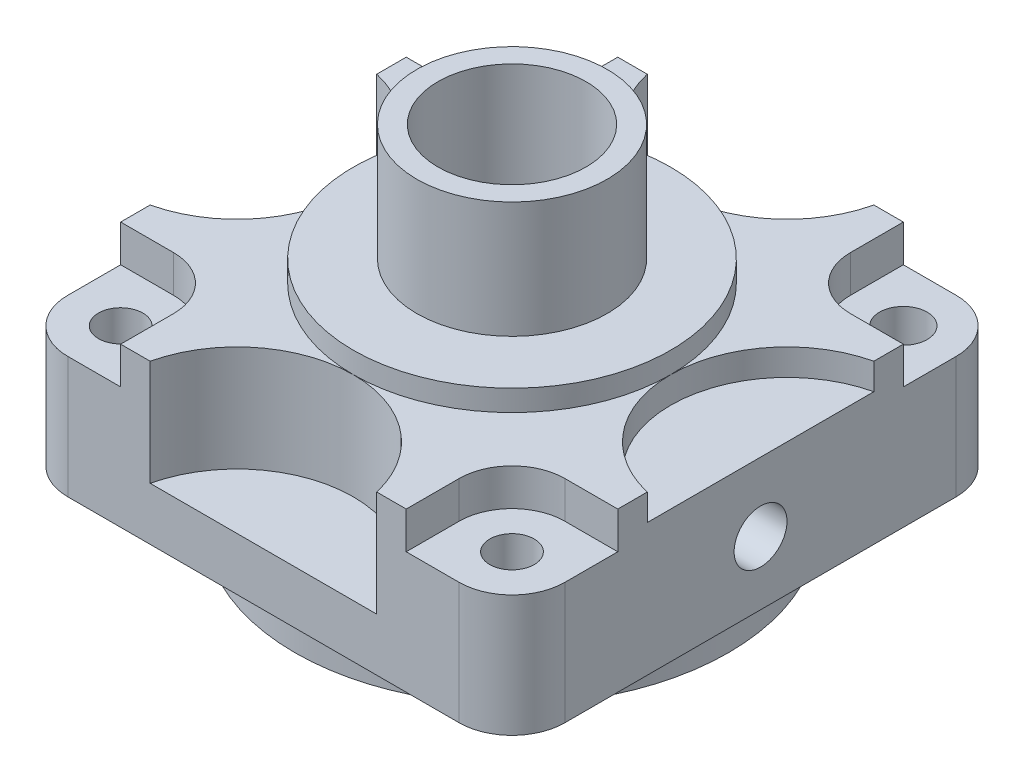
SolidWorks part; units mm, degrees
ref_plane "Plan de face" through (0, 0, 0) normal (0, 0, 1) x (1, 0, 0)
ref_plane "Plan de dessus" through (0, 0, 0) normal (0, 1, 0) x (1, 0, 0)
ref_plane "Plan de droite" through (0, 0, 0) normal (1, 0, 0) x (0, 0, -1)
sketch "Esquisse1" plane through (0, 0, 0) normal (0, 0, 1) x (1, 0, 0)
  line L1 (-23.5, 15) -> (23.5, 15)
  line L2 (-23.5, 15) -> (-23.5, 0)
  line L3 (-23.5, 0) -> (23.5, 0)
  line L4 (23.5, 15) -> (23.5, 0)
  dimension "D1" = 47
  dimension "D2" = 23.5
  dimension "D3" = 15
extrude "Extrusion1" add sketch "Esquisse1" along normal blind 47
sketch "Esquisse2" plane through (0, 0, 0) normal (0, -1, 0) x (1, 0, 0)
  circle A0 centre (0, 23.5285) radius 20.5
  dimension "D1" = 41
extrude "Extrusion2" add sketch "Esquisse2" along normal blind 5
sketch "Esquisse3" plane through (0, -5, 0) normal (0, -1, 0) x (1, 0, 0)
  circle A0 centre (0, 23.5285) radius 9.75
  dimension "D1" = 19.5
extrude "Extrusion3" add sketch "Esquisse3" along normal blind 3.5
sketch "Esquisse4" plane through (0, 15, 0) normal (0, 1, 0) x (-1, 0, 0)
  line L0 (-23.5, 47) -> (-23.5, 0) construction
  circle A0 centre (0, 23.5) radius 15
  dimension "D1" = 30
  dimension "D2" = 23.5
  dimension "D3" = 23.5
extrude "Extrusion4" add sketch "Esquisse4" along normal blind 2
sketch "Esquisse5" plane through (0, 17, 0) normal (0, 1, 0) x (-1, 0, 0)
  circle A0 centre (0, 23.5) radius 9
  dimension "D1" = 18
extrude "Extrusion5" add sketch "Esquisse5" along normal blind 11
sketch "Esquisse6" plane through (0, 28, 0) normal (0, 1, 0) x (-1, 0, 0)
  circle A0 centre (0, 23.5) radius 7
  dimension "D1" = 14
extrude "Enlèv. mat.-Extru.1" cut sketch "Esquisse6" against normal blind 13
sketch "Esquisse7" plane through (0, 15, 0) normal (0, 1, 0) x (-1, 0, 0)
  circle A0 centre (0, 23.5) radius 5.75
  dimension "D1" = 11.5
extrude "Enlèv. mat.-Extru.2" cut sketch "Esquisse7" against normal through all
sketch "Esquisse8" plane through (0, -8.5, 0) normal (0, -1, 0) x (1, 0, 0)
  circle A0 centre (0, 23.5285) radius 8.25
  dimension "D1" = 16.5
extrude "Enlèv. mat.-Extru.3" cut sketch "Esquisse8" against normal blind 17
sketch "Esquisse9" plane through (0, 15, 0) normal (0, 1, 0) x (-1, 0, 0)
  line L0 (0, -14.2918) -> (0, 143.899) construction
  line L1 (0, 23.5) -> (-77.8064, 23.5) construction
  line L2 (-23.5, 0) -> (23.5, 0) construction
  line L3 (23.5, 47) -> (23.5, 0) construction
  line L4 (0, 23.5) -> (84.5721, 23.5) construction
  line L5 (-23.5, 47) -> (23.5, 47) construction
  line L6 (-10.7121, 0) -> (10.7121, 0)
  line L13 (-10.7121, 47) -> (10.7121, 47)
  line L14 (23.5, 12.7879) -> (23.5, 34.2121)
  circle A2 centre (0, 23.5) radius 15 construction
  arc A3 (23.5, 34.2121) -> (23.5, 12.7879) centre (26, 23.5) ccw
  arc A4 (10.7121, 0) -> (-10.7121, 0) centre (0, -2.5) ccw
  arc A5 (-10.7121, 47) -> (10.7121, 47) centre (0, 49.5) ccw
  circle A6 centre (0, 23.5) radius 15 construction
  dimension "D1" = 22
  dimension "D2" = 22
  dimension "D3" = 22
extrude "Enlèv. mat.-Extru.4" cut sketch "Esquisse9" against normal blind 10
hole_wizard "Trou taraudé M63" positions "Esquisse3D1" profile "Esquisse11" tap size "M6" standard "ISO"
sketch3d "Esquisse3D1"
  line L0 (23.5, 0, 47) -> (23.5, 0, 0) construction
  line L2 (23.5, 0, 0) -> (23.5, 15, 0) construction
  point P0 (23.5, 6, 23.5)
  point P11 (0, -12.364, -29.4152)
  dimension "D1" = 6
  dimension "D2" = 23.5
sketch "Esquisse11" plane through (23.5, 6, 23.5) normal (0, 1, 0) x (0, 0, -1)
  line L0 (0, 0) -> (0, 13.5022)
  line L1 (0, 13.5022) -> (2.5, 12)
  line L2 (2.5, 12) -> (2.5, 0)
  line L5 (2.5, 0) -> (0, 0)
  line L10 (0, 13.5022) -> (-2.5, 12) construction
  line L11 (0, -6.35) -> (0, 107.95) construction
  dimension "Diamètre du trou pour taraudage" = 5
  dimension "Profondeur du trou pour taraudage" = 12
  dimension "Angle de pointe" = 118
sketch "Esquisse10" plane through (0, 15, 0) normal (0, 1, 0) x (-1, 0, 0)
  line L0 (-23.5, 47) -> (-23.5, 0) construction
  line L4 (-23.5, 12.7879) -> (-23.5, 34.2121)
  line L5 (0, 23.5) -> (-76.4829, 23.5) construction
  arc A2 (-23.5, 12.7879) -> (-23.5, 34.2121) centre (-26, 23.5) ccw
  circle A4 centre (0, 23.5) radius 15 construction
  dimension "D1" = 22
extrude "Enlèv. mat.-Extru.5" cut sketch "Esquisse10" against normal blind 2.5
sketch "Esquisse12" plane through (0, 15, 0) normal (0, 1, 0) x (-1, 0, 0)
  line L0 (-18.5, -19.8609) -> (-18.5, 147.4969) construction
  line L1 (-77.3053, 42) -> (75.0437, 42) construction
  line L2 (-77.3053, 5) -> (73.399, 5) construction
  line L3 (18.5, -17.0081) -> (18.5, 151.795) construction
  circle A0 centre (0, 23.5) radius 5.75 construction
  circle A1 centre (-18.5, 5) radius 2.25
  circle A2 centre (-18.5, 42) radius 2.1
  circle A4 centre (18.5, 42) radius 2.1
  circle A5 centre (18.5, 5) radius 2.1
  dimension "D5" = 4.5
  dimension "D6" = 4.2
  dimension "D7" = 4.2
  dimension "D8" = 4.2
  dimension "D1" = 18.5
  dimension "D2" = 18.5
  dimension "D3" = 18.5
  dimension "D4" = 18.5
extrude "Enlèv. mat.-Extru.6" cut sketch "Esquisse12" against normal through all
fillet "Congé1" radius 5 4 edges at (-23.5, 7.5, 47) (-23.5, 7.5, 0) (23.5, 7.5, 47) (23.5, 7.5, 0)
sketch "Esquisse13" plane through (0, 15, 0) normal (0, 1, 0) x (1, 0, 0)
  line L0 (13.5, -42) -> (13.5, -47)
  line L1 (18.5, -47) -> (10.7121, -47) construction
  line L2 (13.5, -47) -> (18.5, -47)
  line L3 (18.5, -37) -> (23.5, -37)
  line L4 (23.5, -42) -> (23.5, -34.2121) construction
  line L5 (23.5, -37) -> (23.5, -42)
  line L6 (18.5, -10) -> (23.5, -10)
  line L7 (23.5, -12.7879) -> (23.5, -5) construction
  line L8 (23.5, -10) -> (23.5, -5)
  line L9 (13.5, -5) -> (13.5, 0)
  line L10 (18.5, 0) -> (10.7121, 0) construction
  line L11 (13.5, 0) -> (18.5, 0)
  line L12 (-13.5, -5) -> (-13.5, 0)
  line L13 (-10.7121, 0) -> (-18.5, 0) construction
  line L14 (-13.5, 0) -> (-18.5, 0)
  line L15 (-18.5, -10) -> (-23.5, -10)
  line L16 (-23.5, -12.7879) -> (-23.5, -5) construction
  line L17 (-23.5, -10) -> (-23.5, -5)
  line L18 (-13.5, -42) -> (-13.5, -47)
  line L19 (-10.7121, -47) -> (-18.5, -47) construction
  line L20 (-13.5, -47) -> (-18.5, -47)
  line L21 (-18.5, -37) -> (-23.5, -37)
  line L22 (-23.5, -42) -> (-23.5, -34.2121) construction
  line L23 (-23.5, -37) -> (-23.5, -42)
  arc A0 (18.5, -47) -> (23.5, -42) centre (18.5, -42) ccw
  arc A1 (23.5, -5) -> (18.5, 0) centre (18.5, -5) ccw
  arc A2 (-18.5, 0) -> (-23.5, -5) centre (-18.5, -5) ccw
  arc A3 (-13.5, -42) -> (-18.5, -37) centre (-18.5, -42) ccw
  arc A4 (18.5, -37) -> (13.5, -42) centre (18.5, -42) ccw
  arc A5 (13.5, -5) -> (18.5, -10) centre (18.5, -5) ccw
  arc A6 (-18.5, -10) -> (-13.5, -5) centre (-18.5, -5) ccw
  arc A7 (-23.5, -42) -> (-18.5, -47) centre (-18.5, -42) ccw
extrude "Extrusion11" cut sketch "Esquisse13" against normal blind 3.5
sketch "Esquisse14" plane through (0, -5, 0) normal (0, -1, 0) x (1, 0, 0)
  line L0 (-18.5, 0) -> (18.5, 0) construction
  circle A0 centre (16, 23.5) radius 2
  point P2 (0, 0)
  point P5 (0, 0)
  dimension "D1" = 4
  dimension "D2" = 23.5
  dimension "D3" = 16
extrude "Enlèv. mat.-Extru.7" cut sketch "Esquisse14" against normal blind 10
